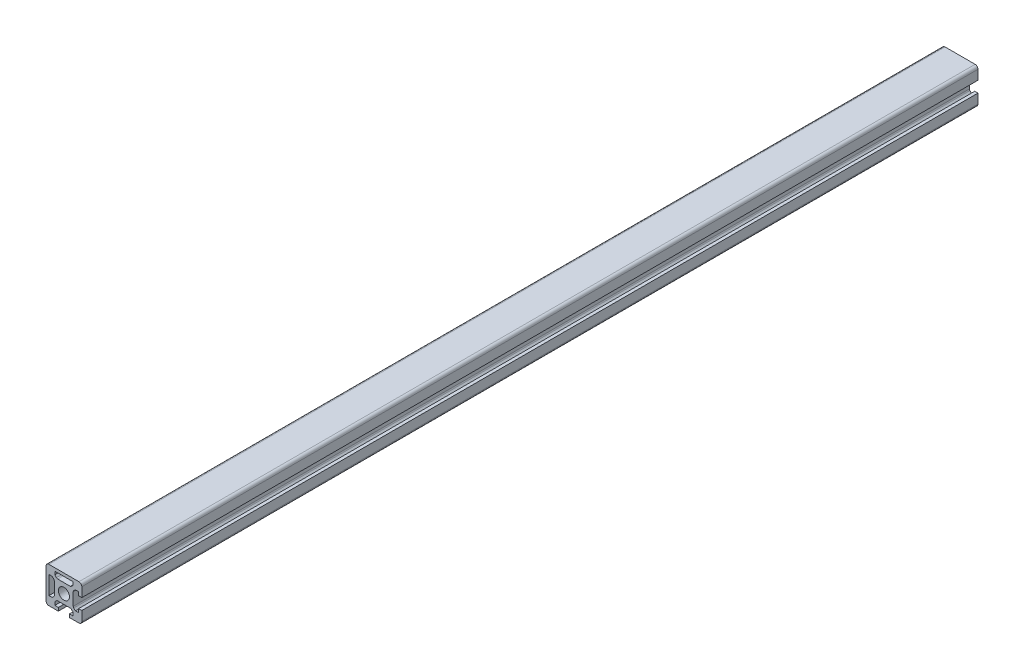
SolidWorks part; units mm, degrees
ref_plane "Front" through (0, 0, 0) normal (0, 0, 1) x (1, 0, 0)
ref_plane "Top" through (0, 0, 0) normal (0, 1, 0) x (1, 0, 0)
ref_plane "Right" through (0, 0, 0) normal (1, 0, 0) x (0, 0, -1)
ref_plane "Plan1" through (0, 0, 1) normal (0, 0, 1) x (1, 0, 0)
sketch "Esquisse1" plane through (0, 0, 1) normal (0, 0, 1) x (1, 0, 0)
  line L0 (3.4858, 5.35) -> (-3.4858, 5.35)
  line L1 (-4.1929, 5.6429) -> (-5.1, 6.55)
  line L2 (-5.1, 6.55) -> (-5.1, 8.35)
  line L3 (-5.1, 8.35) -> (5.1, 8.35)
  line L4 (5.1, 8.35) -> (5.1, 6.55)
  line L5 (5.1, 6.55) -> (4.1929, 5.6429)
  line L6 (-10, 8.4) -> (-10, -8.4)
  line L7 (-8.4, -10) -> (-3.1, -10)
  line L8 (-3.1, -10) -> (-3.1, -8.2)
  line L9 (-3.1, -8.2) -> (-5.1, -8.2)
  line L10 (-5.1, -8.2) -> (-5.1, -6.4)
  line L11 (-5.1, -6.4) -> (-4.1929, -5.4929)
  line L12 (-3.4858, -5.2) -> (3.4858, -5.2)
  line L13 (4.1929, -5.4929) -> (5.1, -6.4)
  line L14 (5.1, -6.4) -> (5.1, -8.2)
  line L15 (5.1, -8.2) -> (3.1, -8.2)
  line L16 (3.1, -8.2) -> (3.1, -10)
  line L17 (3.1, -10) -> (8.4, -10)
  line L18 (10, -8.4) -> (10, -3.1)
  line L19 (10, -3.1) -> (8.2, -3.1)
  line L20 (8.2, -3.1) -> (8.2, -5.1)
  line L21 (8.2, -5.1) -> (6.4, -5.1)
  line L22 (6.4, -5.1) -> (5.4929, -4.1929)
  line L23 (5.2, -3.4858) -> (5.2, 3.4858)
  line L24 (5.4929, 4.1929) -> (6.4, 5.1)
  line L25 (6.4, 5.1) -> (8.2, 5.1)
  line L26 (8.2, 5.1) -> (8.2, 3.1)
  line L27 (8.2, 3.1) -> (10, 3.1)
  line L28 (10, 3.1) -> (10, 8.4)
  line L29 (8.4, 10) -> (-8.4, 10)
  line L30 (-5.35, 3.4858) -> (-5.35, -3.4858)
  line L31 (-5.6429, -4.1929) -> (-6.55, -5.1)
  line L32 (-6.55, -5.1) -> (-8.35, -5.1)
  line L33 (-8.35, -5.1) -> (-8.35, 5.1)
  line L34 (-8.35, 5.1) -> (-6.55, 5.1)
  line L35 (-6.55, 5.1) -> (-5.6429, 4.1929)
  circle A0 centre (0, 0) radius 3.1
  arc A1 (-3.4858, 5.35) -> (-4.1929, 5.6429) centre (-3.4858, 6.35) cw
  arc A2 (4.1929, 5.6429) -> (3.4858, 5.35) centre (3.4858, 6.35) cw
  arc A3 (-8.4, 10) -> (-10, 8.4) centre (-8.4, 8.4) ccw
  arc A4 (-10, -8.4) -> (-8.4, -10) centre (-8.4, -8.4) ccw
  arc A5 (-4.1929, -5.4929) -> (-3.4858, -5.2) centre (-3.4858, -6.2) cw
  arc A6 (3.4858, -5.2) -> (4.1929, -5.4929) centre (3.4858, -6.2) cw
  arc A7 (8.4, -10) -> (10, -8.4) centre (8.4, -8.4) ccw
  arc A8 (5.4929, -4.1929) -> (5.2, -3.4858) centre (6.2, -3.4858) cw
  arc A9 (5.2, 3.4858) -> (5.4929, 4.1929) centre (6.2, 3.4858) cw
  arc A10 (10, 8.4) -> (8.4, 10) centre (8.4, 8.4) ccw
  arc A11 (-5.35, -3.4858) -> (-5.6429, -4.1929) centre (-6.35, -3.4858) cw
  arc A12 (-5.6429, 4.1929) -> (-5.35, 3.4858) centre (-6.35, 3.4858) cw
extrude "Boss.-Extru.1" add sketch "Esquisse1" against normal blind 500
